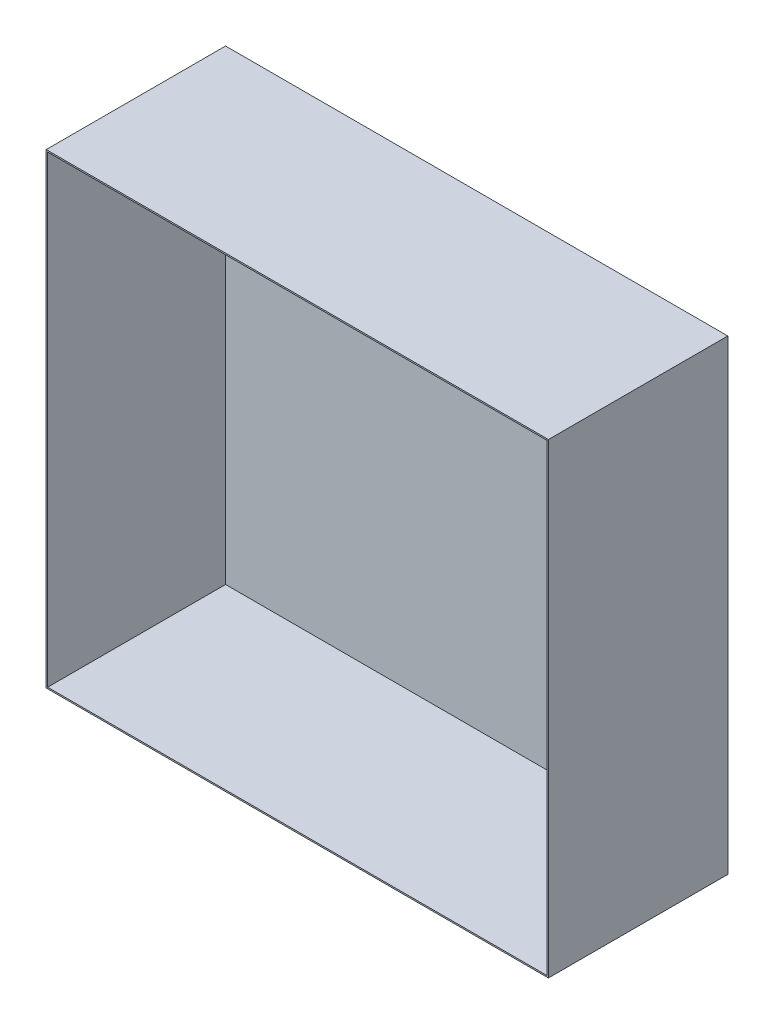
SolidWorks part; units mm, degrees
ref_plane "Plan de face" through (0, 0, 0) normal (0, 0, 1) x (1, 0, 0)
ref_plane "Plan de dessus" through (0, 0, 0) normal (0, 1, 0) x (1, 0, 0)
ref_plane "Plan de droite" through (0, 0, 0) normal (1, 0, 0) x (0, 0, -1)
sketch "EW_SKETCH" plane through (0, 0, 0) normal (0, 0, 1) x (1, 0, 0)
  line L0 (-350, 0) -> (350, 0)
  line L1 (350, 0) -> (350, 650)
  line L2 (350, 650) -> (-350, 650)
  line L3 (-350, 650) -> (-350, 0)
  dimension "EW_HEIGHT" = 650
  dimension "EW_WIDTH" = 700
extrude "EW_EXTRUDE" add sketch "EW_SKETCH" along normal blind 250
shell "Coque2" thickness 2
